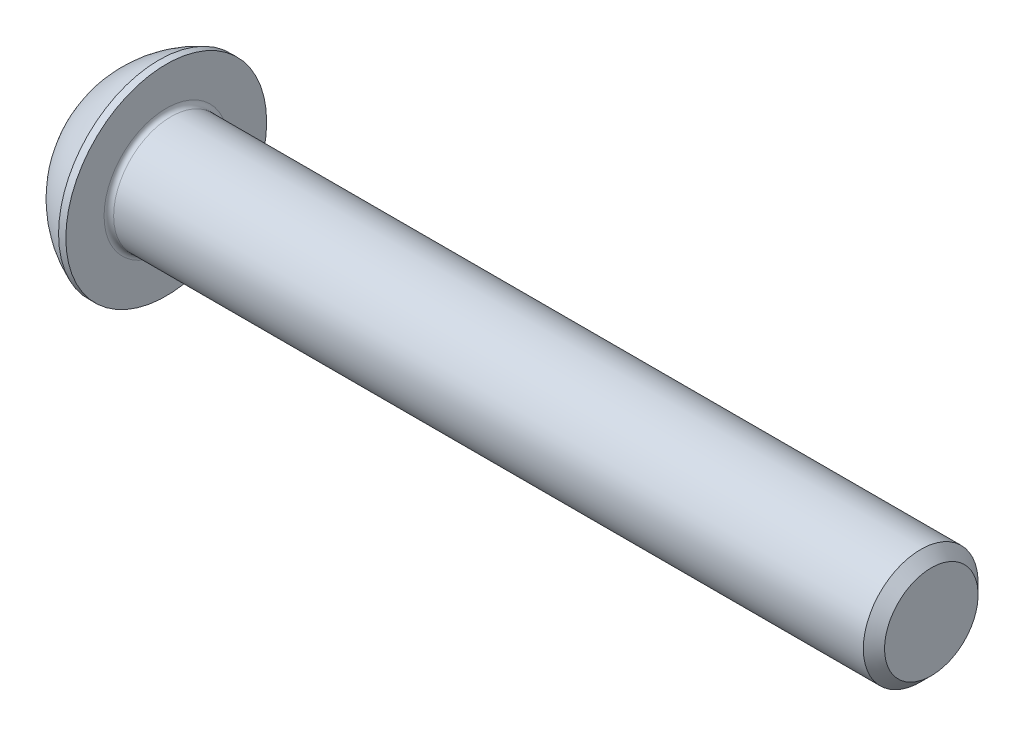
SolidWorks part; units mm, degrees
ref_plane "Plane1" through (0, 0, 0) normal (0, 0, 1) x (1, 0, 0)
ref_plane "Plane2" through (0, 0, 0) normal (0, 1, 0) x (1, 0, 0)
ref_plane "Plane3" through (0, 0, 0) normal (1, 0, 0) x (0, 0, -1)
sketch "BodySke" plane through (0, 0, 0) normal (0, 0, 1) x (1, 0, 0)
  line L0 (43.3, 0) -> (43.3, 2.4455)
  line L1 (42.7455, 3) -> (3.3, 3)
  line L2 (3.3, 3) -> (3.3, 5.25)
  line L3 (3.3, 5.25) -> (2.92, 5.25)
  line L4 (0, 0) -> (101.6, 0) construction
  line L5 (3.3, -5.25) -> (2.92, -5.25) construction
  line L6 (55.6768, -3) -> (3.3, -3) construction
  line L7 (43.3, 0) -> (0, 0)
  line L8 (0, 2.625) -> (0, -2.625) construction
  line L9 (0, 0) -> (0, 2.625)
  line L10 (43.3, 2.4455) -> (42.7455, 3)
  line L11 (43.3, -2.4455) -> (42.7455, -3) construction
  line L12 (4.3, 9.525) -> (4.3, -3) construction
  line L13 (3.3, 9.525) -> (3.3, -3) construction
  arc A1 (0, 2.625) -> (2.92, 5.25) centre (4.9997, 0) cw
revolve "BaseBody" add sketch "BodySke" angle 360 about L4
fillet "Fillet1" radius 0.25 1 edges at (3.3, 0, 3)
sketch "Sketch2" plane through (0, 0, 0) normal (0, 0, 1) x (1, 0, 0)
  line L0 (0, 2) -> (2.08, 2)
  line L1 (2.08, 2) -> (3.2347, 0)
  line L3 (3.2347, 0) -> (0, 0)
  line L4 (0, 0) -> (0, 2)
  line L5 (0, -2) -> (2.08, -2) construction
  line L6 (0, 0) -> (47.625, 0) construction
  dimension "D2" = 60
  dimension "PreBroach_depth" = 2.08
  dimension "PreBroach_dia" = 4
revolve "PreBroach" cut sketch "Sketch2" angle 360 about L6
sketch "Sketch3" plane through (0, 0, 0) normal (1, 0, 0) x (0, 0, -1)
  line L0 (-2, -1.1547) -> (-2, 1.1547)
  line L1 (-2, 1.1547) -> (0, 2.3094)
  line L2 (0, 2.3094) -> (2, 1.1547)
  line L3 (2, 1.1547) -> (2, -1.1547)
  line L4 (2, -1.1547) -> (0, -2.3094)
  line L5 (0, -2.3094) -> (-2, -1.1547)
extrude "Hex" cut sketch "Sketch3" along normal blind 2.08
sketch "ThdSchSke" plane through (0, 0, 0) normal (0, 0, 1) x (1, 0, 0)
  line L0 (5.3, -2.4455) -> (4.9117, -3)
  line L1 (5.3, -2.4455) -> (5.6883, -3)
  line L2 (5.6883, -3) -> (5.6883, -3.75)
  line L3 (-3.175, 0) -> (5.1513, 0) construction
  line L5 (5.6883, -3.75) -> (4.9117, -3.75)
  line L6 (4.9117, -3.75) -> (4.9117, -3)
revolve "ThreadSchematic" [suppressed] cut sketch "ThdSchSke" angle 360 about L3
pattern_linear "ThdSchPat" [suppressed]
equation "\"D1@BodySke\" = \"Head_dia@BodySke\" * .5"
equation "\"Thread_minor@ThreadCosmetic\" = \"Minor_dia@BodySke\""
equation "\"D1@Sketch3\" = \"Hex_size@Sketch3\" / 2"
equation "\"D2@Sketch3\" = \"D1@Sketch3\""
equation "\"D3@Sketch3\" = \"Hex_size@Sketch3\""
equation "\"Thread_length@ThreadCosmetic\" = ((sgn( (\"Length@BodySke\" - \"Advance@BodySke\" * 2.0) - \"Thread_nom@BodySke\" )-1)*( (\"Length@BodySke\" - \"Advance@BodySke\" * 2.0) - \"Thread_nom@BodySke\" ))/-2+ \"Thread_no"
equation "\"Thread_minor@ThdSchSke\" = \"Minor_dia@BodySke\""
equation "\"Diameter@ThdSchSke\" = \"Diameter@BodySke\""
equation "\"Overcut@ThdSchSke\" = \"Diameter@BodySke\" * 1.25"
equation "\"Start@ThdSchSke\" = \"Head_ht@BodySke\" + \"Length@BodySke\" - \"Thread_length@ThreadCosmetic\"  '---Non-countersunk---"
equation "\"Num_threads@ThdSchPat\" = int( \"Thread_length@ThreadCosmetic\" / \"Advance@BodySke\" + 0.999 )  + 1"
equation "\"Advance@ThdSchPat\" = \"Thread_length@ThreadCosmetic\" /  (\"Num_threads@ThdSchPat\" - 1) 'relax it"
equation "\"Num_threads@ThdSchPat\" = \"Num_threads@ThdSchPat\" - sgn( \"Num_threads@ThdSchPat\" - 1) '---chamfered tips only---"
